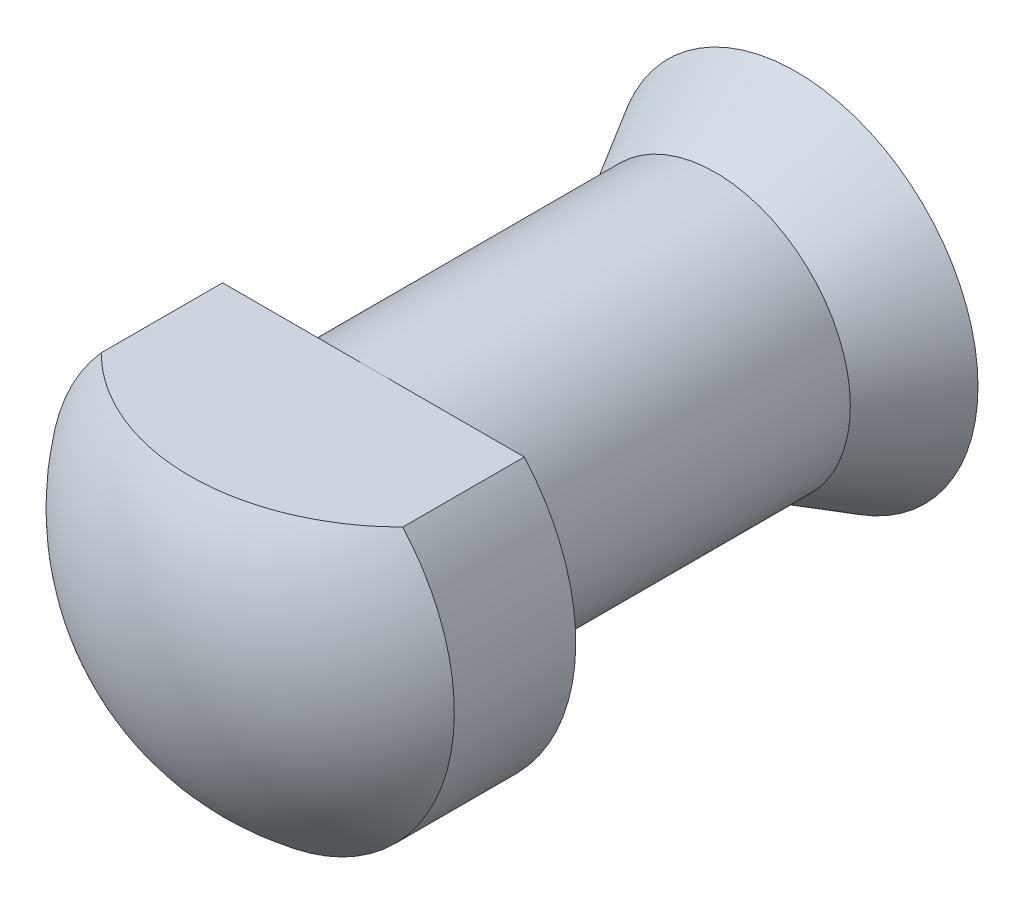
SolidWorks part; units mm, degrees
ref_plane "Спереди" through (0, 0, 0) normal (0, 0, 1) x (1, 0, 0)
ref_plane "Сверху" through (0, 0, 0) normal (0, 1, 0) x (1, 0, 0)
ref_plane "Справа" through (0, 0, 0) normal (1, 0, 0) x (0, 0, -1)
sketch "Эскиз1" plane through (0, 0, 0) normal (1, 0, 0) x (0, 0, -1)
  line L0 (0, 0) -> (32.5564, 0) construction
  line L1 (0, 0) -> (13.1535, 0)
  line L2 (1.905, -3.81) -> (4.191, -3.81)
  line L3 (4.191, -3.81) -> (4.191, -2.54)
  line L4 (4.191, -2.54) -> (10.6299, -2.54)
  line L5 (10.6299, -2.54) -> (12.1539, -3.4199)
  arc A0 (1.905, -3.81) -> (0, 0) centre (4.7625, 0) cw
  arc A1 (12.1539, -3.4199) -> (13.1535, 0) centre (6.8035, 0) ccw
  dimension "D6" = 6.35
  dimension "D7" = 4.7625
  dimension "D1" = 5.08
  dimension "D2" = 30
  dimension "D3" = 1.524
  dimension "D4" = 4.191
  dimension "D5" = 7.62
  dimension "D8" = 7.9629
revolve "Повернуть1" add sketch "Эскиз1" angle 360 about L0
sketch "Эскиз2" plane through (0, 0, -4.191) normal (0, 0, -1) x (-1, 0, 0)
  line L1 (3.81, 3.81) -> (-3.81, 3.81)
  line L2 (3.81, 3.81) -> (3.81, 2.54)
  line L3 (3.81, 2.54) -> (-3.81, 2.54)
  line L4 (-3.81, 3.81) -> (-3.81, 2.54)
  circle A0 centre (0, 0) radius 2.54 construction
  circle A1 centre (0, 0) radius 3.81 construction
extrude "Вырез-Вытянуть1" cut sketch "Эскиз2" against normal through all
